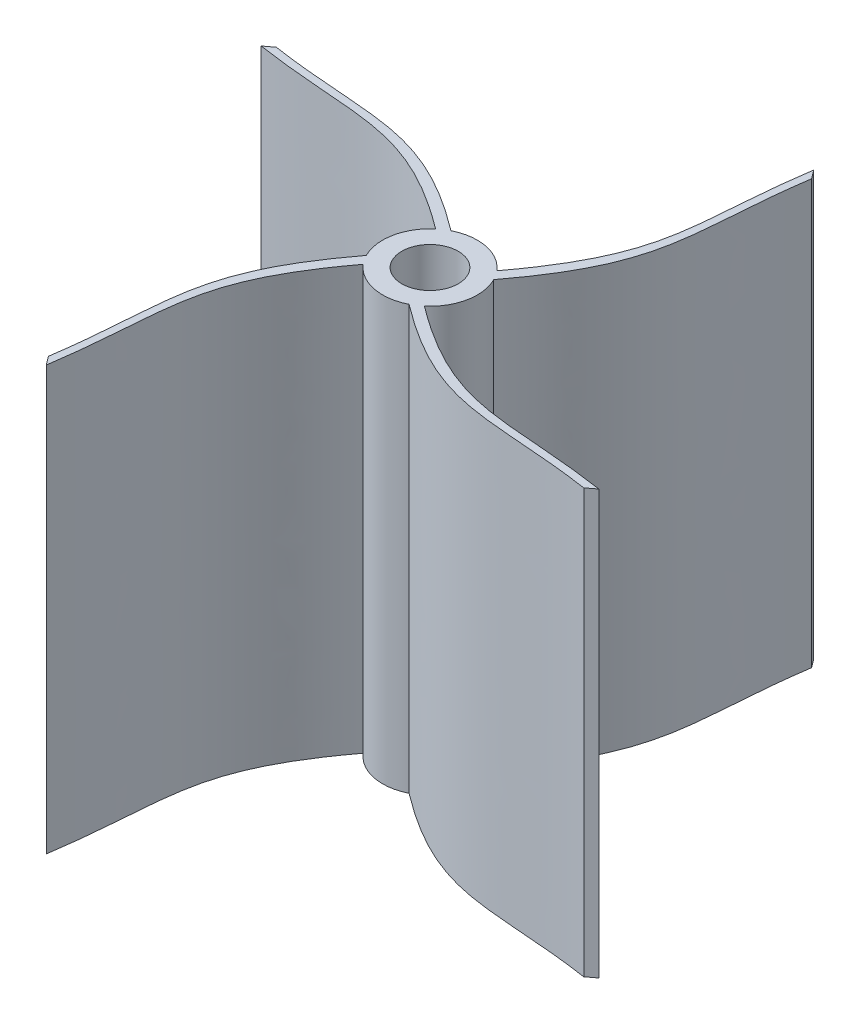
SolidWorks part; units mm, degrees
ref_plane "Front Plane" through (0, 0, 0) normal (0, 0, 1) x (1, 0, 0)
ref_plane "Top Plane" through (0, 0, 0) normal (0, 1, 0) x (1, 0, 0)
ref_plane "Right Plane" through (0, 0, 0) normal (1, 0, 0) x (0, 0, -1)
sketch "Sketch1" plane through (0, 0, 0) normal (0, 1, 0) x (1, 0, 0)
  line L0 (0, 0) -> (-71.1605, 53.3874) construction
  line L1 (-71.1605, 53.3874) -> (-97.2351, 38.7856) construction
  line L2 (-97.2351, 38.7856) -> (-174.027, 50.4298) construction
  line L3 (6.5547, 4.3398) -> (-64.6856, 58.1789) construction
  line L4 (-64.6856, 58.1789) -> (-90.7603, 43.577) construction
  line L5 (-90.7603, 43.577) -> (-167.9414, 55.0499) construction
  line L6 (-167.9414, 55.0499) -> (-174.027, 50.4298)
  line L7 (102.4134, 163.9844) -> (97.7933, 170.0699)
  line L8 (47.3635, -3.957) -> (100.7509, 67.2035) construction
  line L9 (100.7509, 67.2035) -> (86.1491, 93.2781) construction
  line L10 (86.1491, 93.2781) -> (97.7933, 170.0699) construction
  line L11 (51.7032, -10.5117) -> (105.5423, 60.7286) construction
  line L12 (105.5423, 60.7286) -> (90.9405, 86.8033) construction
  line L13 (90.9405, 86.8033) -> (102.4134, 163.9844) construction
  line L14 (211.3479, -106.3704) -> (217.4334, -101.7503)
  line L15 (43.4065, -51.3205) -> (114.5669, -104.7079) construction
  line L16 (114.5669, -104.7079) -> (140.6416, -90.1061) construction
  line L17 (140.6416, -90.1061) -> (217.4334, -101.7503) construction
  line L18 (36.8518, -55.6602) -> (108.0921, -109.4993) construction
  line L19 (108.0921, -109.4993) -> (134.1668, -94.8975) construction
  line L20 (134.1668, -94.8975) -> (211.3479, -106.3704) construction
  line L21 (-59.0069, -215.3049) -> (-54.3868, -221.3904)
  line L22 (-3.957, -47.3635) -> (-57.3444, -118.5239) construction
  line L23 (-57.3444, -118.5239) -> (-42.7426, -144.5986) construction
  line L24 (-42.7426, -144.5986) -> (-54.3868, -221.3904) construction
  line L25 (-8.2968, -40.8088) -> (-62.1359, -112.0491) construction
  line L26 (-62.1359, -112.0491) -> (-47.534, -138.1238) construction
  line L27 (-47.534, -138.1238) -> (-59.0069, -215.3049) construction
  arc A0 (0, 0) -> (-8.2968, -40.8088) centre (21.7032, -25.6602) ccw
  arc A1 (47.3635, -3.957) -> (6.5547, 4.3398) centre (21.7032, -25.6602) ccw
  arc A2 (-3.957, -47.3635) -> (36.8518, -55.6602) centre (21.7032, -25.6602) ccw
  arc A3 (43.4065, -51.3205) -> (51.7032, -10.5117) centre (21.7032, -25.6602) ccw
  spline S0 degree 3 poles (0, 0) (-71.1605, 53.3874) (-97.2351, 38.7856) (-174.027, 50.4298) knots 0 0 0 0 1 1 1 1
  spline S1 degree 3 poles (6.5547, 4.3398) (-64.6856, 58.1789) (-90.7603, 43.577) (-167.9414, 55.0499) knots 0 0 0 0 1 1 1 1
  spline S2 degree 3 poles (51.7032, -10.5117) (105.5423, 60.7286) (90.9405, 86.8033) (102.4134, 163.9844) knots 0 0 0 0 1 1 1 1
  spline S3 degree 3 poles (47.3635, -3.957) (100.7509, 67.2035) (86.1491, 93.2781) (97.7933, 170.0699) knots 0 0 0 0 1 1 1 1
  spline S4 degree 3 poles (36.8518, -55.6602) (108.0921, -109.4993) (134.1668, -94.8975) (211.3479, -106.3704) knots 0 0 0 0 1 1 1 1
  spline S5 degree 3 poles (43.4065, -51.3205) (114.5669, -104.7079) (140.6416, -90.1061) (217.4334, -101.7503) knots 0 0 0 0 1 1 1 1
  spline S6 degree 3 poles (-8.2968, -40.8088) (-62.1359, -112.0491) (-47.534, -138.1238) (-59.0069, -215.3049) knots 0 0 0 0 1 1 1 1
  spline S7 degree 3 poles (-3.957, -47.3635) (-57.3444, -118.5239) (-42.7426, -144.5986) (-54.3868, -221.3904) knots 0 0 0 0 1 1 1 1
  point P38 (21.7032, -25.6602)
  dimension "D2" = 30
  dimension "D3" = 420
  dimension "D1" = 4
extrude "Boss-Extrude1" add sketch "Sketch1" along normal blind 300
sketch "Sketch3" plane through (0, 300, 0) normal (0, 1, 0) x (1, 0, 0)
  circle A0 centre (21.7032, -25.6602) radius 20
  dimension "D1" = 40
extrude "Cut-Extrude1" cut sketch "Sketch3" against normal blind 250
